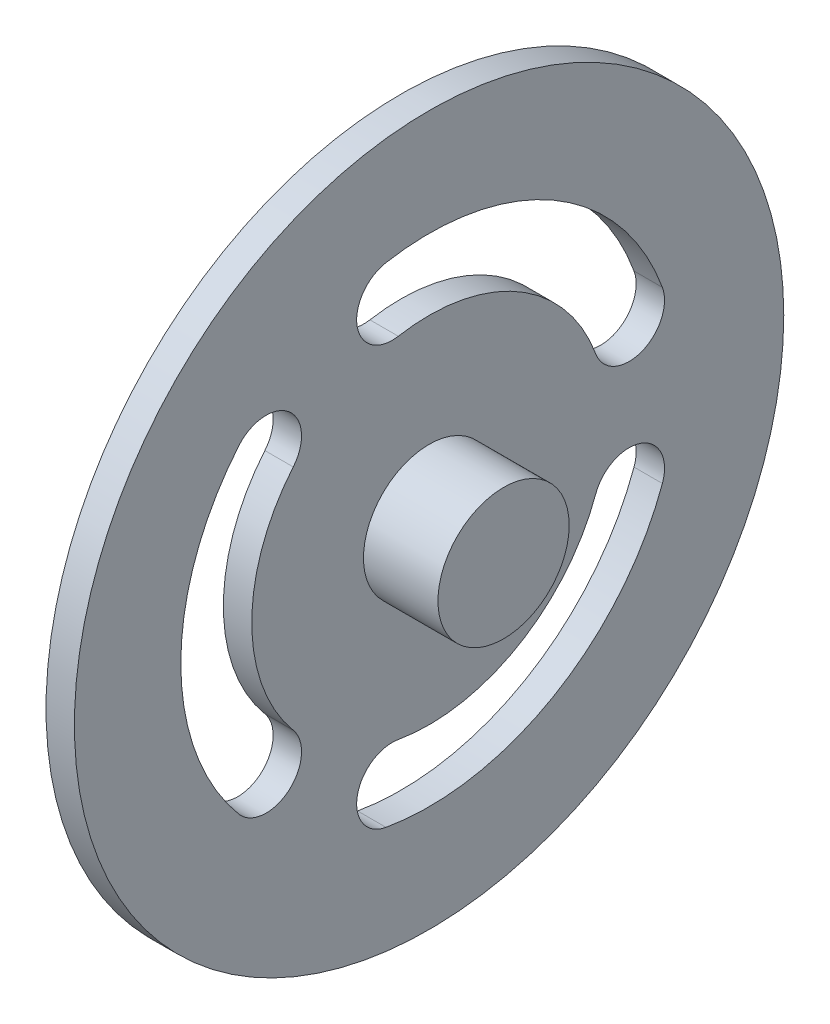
SolidWorks part; units mm, degrees
ref_plane "Front Plane" through (0, 0, 0) normal (0, 0, 1) x (1, 0, 0)
ref_plane "Top Plane" through (0, 0, 0) normal (0, 1, 0) x (1, 0, 0)
ref_plane "Right Plane" through (0, 0, 0) normal (1, 0, 0) x (0, 0, -1)
sketch "Sketch1" plane through (0, 0, 0) normal (0, 0, 1) x (1, 0, 0)
  line L0 (0, 0) -> (25, 0) construction
  line L1 (0, 0) -> (0, 100) construction
  line L2 (25, 0) -> (25, 18.5)
  line L3 (25, 18.5) -> (4, 18.5)
  line L4 (4, 18.5) -> (4, 100)
  line L5 (4, 100) -> (-4, 100)
  line L6 (-25, 0) -> (-25, 18.5)
  line L7 (-25, 18.5) -> (-4, 18.5)
  line L8 (-4, 18.5) -> (-4, 100)
  line L9 (25, 0) -> (-25, 0)
  dimension "D1" = 8
  dimension "D2" = 200
  dimension "D3" = 37
  dimension "D4" = 50
revolve "Revolve1" add sketch "Sketch1" angle 360 about L9
sketch "Sketch2" plane through (4, 0, 0) normal (1, 0, 0) x (0, 0, -1)
  line L0 (0, 0) -> (141.5119, 0) construction
  line L1 (0, 0) -> (-74.0933, 128.3334) construction
  line L2 (0, 0) -> (56.3816, 20.5212) construction
  line L3 (0, 0) -> (-10.4189, 59.0885) construction
  arc A0 (56.3816, 20.5212) -> (-10.4189, 59.0885) centre (0, 0) ccw construction
  arc A1 (65.7785, 23.9414) -> (-12.1554, 68.9365) centre (0, 0) ccw
  arc A2 (46.9846, 17.101) -> (-8.6824, 49.2404) centre (0, 0) ccw
  arc A3 (46.9846, 17.101) -> (65.7785, 23.9414) centre (56.3816, 20.5212) ccw
  arc A4 (-12.1554, 68.9365) -> (-8.6824, 49.2404) centre (-10.4189, 59.0885) ccw
  point P4 (30, 51.9615)
  dimension "D4" = 60
  dimension "D5" = 20
  dimension "D1" = 120
  dimension "D2" = 20
  dimension "D3" = 20
extrude "Cut-Extrude1" cut sketch "Sketch2" against normal through all
pattern_circular "CirPattern1" count 3 over 360 about axis through (0, 0, 0) along (1, 0, 0) of "Cut-Extrude1"
